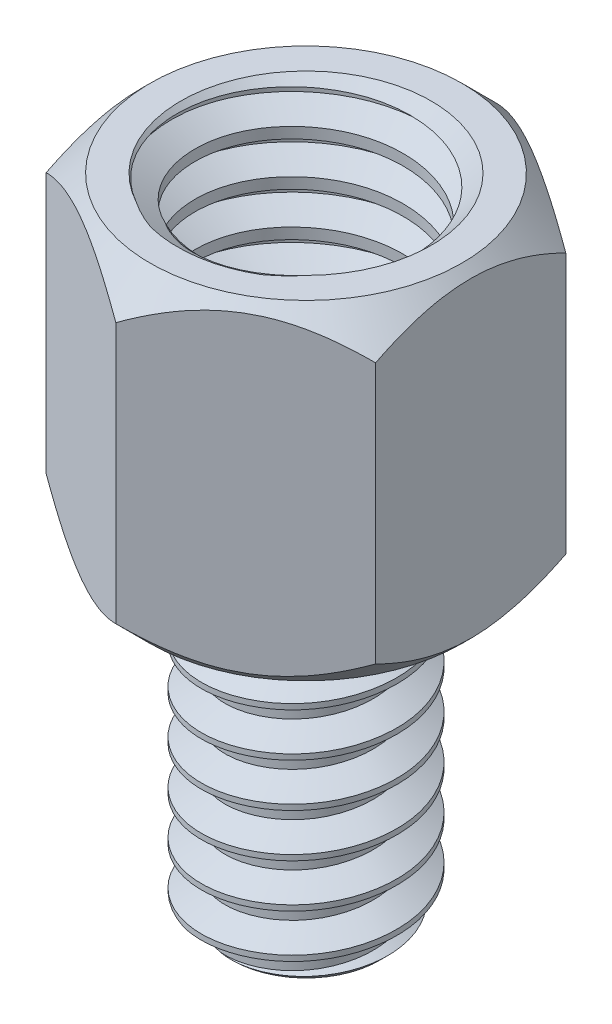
SolidWorks part; units mm, degrees
ref_plane "Спереди" through (0, 0, 0) normal (0, 0, 1) x (1, 0, 0)
ref_plane "Сверху" through (0, 0, 0) normal (0, 1, 0) x (1, 0, 0)
ref_plane "Справа" through (0, 0, 0) normal (1, 0, 0) x (0, 0, -1)
sketch "Эскиз1" plane through (0, 0, 0) normal (0, 1, 0) x (1, 0, 0)
  line L1 (-2.4, 1.3856) -> (-2.4, -1.3856)
  line L2 (-2.4, -1.3856) -> (0, -2.7713)
  line L3 (0, -2.7713) -> (2.4, -1.3856)
  line L4 (2.4, -1.3856) -> (2.4, 1.3856)
  line L5 (2.4, 1.3856) -> (0, 2.7713)
  line L6 (0, 2.7713) -> (-2.4, 1.3856)
  circle A0 centre (0, 0) radius 2.4 construction
  dimension "D1" = 4.8
extrude "Бобышка-Вытянуть1" add sketch "Эскиз1" along normal blind 4.8
sketch "Эскиз2" plane through (0, 0, 0) normal (1, 0, 0) x (0, 0, -1)
  line L0 (0, 0) -> (0, -4.6)
  line L1 (0, -4.6) -> (1.07, -4.6)
  line L2 (1.07, -4.6) -> (1.4224, -4.2476)
  line L3 (1.4224, -4.2476) -> (1.4224, -0.6643)
  line L4 (1.4224, -0.6643) -> (1.07, -0.5)
  line L5 (1.07, -0.5) -> (1.07, 0)
  line L6 (1.3856, 0) -> (2.7713, 0) construction
  line L7 (1.07, 0) -> (0, 0)
  line L8 (1.07, -0.5) -> (1.07, -5.0022) construction
  line L9 (-1.3856, 0) -> (1.3856, 0) construction
  dimension "D1" = 1.4224
  dimension "D2" = 1.07
  dimension "D3" = 4.6
  dimension "D4" = 0.5
  dimension "D5" = 135
  dimension "D6" = 115
revolve "Повернуть2" add sketch "Эскиз2" angle 360 about L0
sketch "Эскиз3" plane through (0, 0, 0) normal (1, 0, 0) x (0, 0, -1)
  line L0 (-2.7713, 4.8) -> (-2.7713, 4.3)
  line L1 (-2.7713, 4.8) -> (-2.7713, 0) construction
  line L2 (-2.7713, 4.3) -> (-2.2713, 4.8)
  line L4 (-2.2713, 4.8) -> (-2.7713, 4.8)
  line L5 (-2.7713, 0) -> (-2.7713, 0.5)
  line L6 (-2.7713, 0.5) -> (-2.2713, 0)
  line L7 (-2.7713, 0) -> (-1.3856, 0) construction
  line L8 (-2.2713, 0) -> (-2.7713, 0)
  dimension "D1" = 0.5
  dimension "D2" = 0.5
  dimension "D3" = 0.5
  dimension "D4" = 0.5
revolve "Вырез-Повернуть1" cut sketch "Эскиз3" angle 360 about axis through (0, 0, 0) along (0, 1, 0)
thread "Резьба1" pitch 0.635 start angle 0, offset 1, length 4.6, pitch 0.635, diameter 2.8448
ref_plane "Плоскость1" through (1.4224, -5.2476, 0) normal (0, 0, 1) x (1, 0, 0)
sketch "Профиль резьбы1" plane through (1.4224, -5.2476, 0) normal (0, 0, 1) x (1, 0, 0)
  line L0 (0, 0) -> (0, 0.635) construction
  line L11 (0, 0) -> (0, 0.5556)
  line L12 (0, 0.5556) -> (-0.3437, 0.3572)
  line L13 (-0.3437, 0.3572) -> (-0.3437, 0.1984)
  line L15 (-0.3437, 0.1984) -> (0, 0)
  line L17 (-0.3437, 0.2778) -> (0, 0.2778) construction
  point P2 (0, 0)
  dimension "Pitch" = 0.635
  dimension "Profile_Angle" = 60
  dimension "Profile_Land" = 0.1588
  dimension "Profile_Height" = 0.3437
sketch "Эскиз8" plane through (0, 4.8, 0) normal (0, 1, 0) x (1, 0, 0)
  point P0 (0, 0)
hole_wizard "Сверло под метчик  спиральное #42" positions "Трехмерный эскиз3" profile "Эскиз9" hole size "#4-40" standard "Ansi Inch"
sketch3d "Трехмерный эскиз3"
  point P0 (0, 4.8, 0)
sketch "Эскиз9" plane through (0, 4.8, 0) normal (1, 0, 0) x (0, 0, 1)
  line L0 (0, 0) -> (0, 4.4157)
  line L1 (0, 4.4157) -> (1.524, 3.5)
  line L2 (1.524, 3.5) -> (1.524, 0)
  line L5 (1.524, 0) -> (0, 0)
  line L10 (0, 4.4157) -> (-1.524, 3.5) construction
  line L11 (0, -6.35) -> (0, 107.95) construction
  dimension "Диаметр отверстия" = 3.048
  dimension "Глубина отверстия" = 3.5
  dimension "Угол заточки сверла" = 118
chamfer "Фаска1" distance 0.3 angle 45 1 edges at (0, 4.8, 1.524)
thread "Резьба2" pitch 0.635 start angle 0, offset 1, length 4, pitch 0.635, diameter 3.048
ref_plane "Плоскость2" through (-1.524, 5.5, 0) normal (0, 0, 1) x (-1, 0, 0)
sketch "Профиль резьбы2" plane through (-1.524, 5.5, 0) normal (0, 0, 1) x (-1, 0, 0)
  line L0 (0, 0) -> (0, 0.635) construction
  line L1 (0, 0) -> (0.3437, 0.1984)
  line L2 (0.3437, 0.1984) -> (0.3437, 0.2778)
  line L3 (0.3437, 0.2778) -> (0, 0.4762)
  line L4 (0.3437, 0.2381) -> (0, 0.2381) construction
  line L11 (0, 0) -> (0, 0.4762)
  point P2 (0, 0)
  dimension "Pitch" = 0.635
  dimension "Profile_Angle" = 60
  dimension "Profile_Land" = 0.0794
  dimension "Profile_Height" = 0.3437
